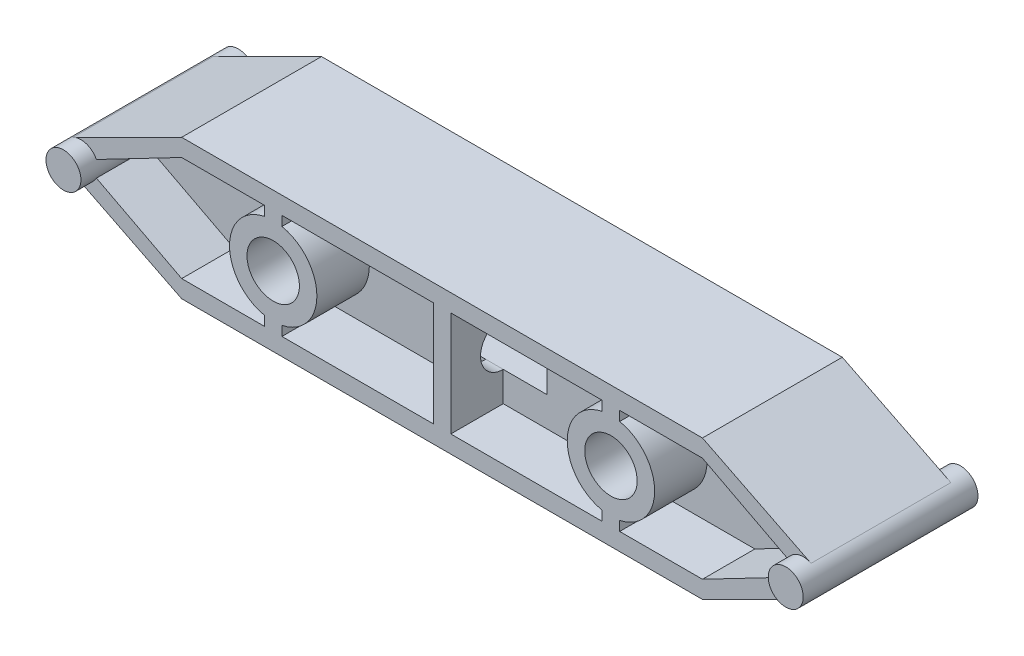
SolidWorks part; units mm, degrees
ref_plane "Front Plane" through (0, 0, 0) normal (0, 0, 1) x (1, 0, 0)
ref_plane "Top Plane" through (0, 0, 0) normal (0, 1, 0) x (1, 0, 0)
ref_plane "Right Plane" through (0, 0, 0) normal (1, 0, 0) x (0, 0, -1)
sketch "Sketch1" plane through (0, 0, 0) normal (0, 0, 1) x (1, 0, 0)
  line L0 (-74.6332, 0) -> (-16.4738, 0)
  line L1 (-64.4732, -5.08) -> (-64.4732, 5.08)
  line L2 (-74.6332, 0) -> (-64.4732, 5.08)
  line L3 (-74.6332, 0) -> (-64.4732, -5.08)
  line L4 (-26.6338, -5.08) -> (-26.6338, 5.08)
  line L5 (-26.6338, 5.08) -> (-16.4738, 0)
  line L6 (-26.6338, -5.08) -> (-16.4738, 0)
  line L7 (-64.4732, 5.08) -> (-26.6338, 5.08)
  line L8 (-64.4732, -5.08) -> (-26.6338, -5.08)
  point P6 (-64.4732, 0)
  point P9 (-26.6338, 0)
  dimension "D1" = 58.1594
  dimension "D2" = 90
  dimension "D3" = 10.16
  dimension "D4" = 10.16
  dimension "D5" = 90
  dimension "D6" = 10.16
  dimension "D7" = 10.16
extrude "Boss-Extrude3" add sketch "Sketch1" along normal blind 10.16 contours L2 L0 L1 | L0 L3 L1 | L7 L1 L0 L4 | L1 L8 L4 L0 | L4 L6 L0 | L5 L4 L0
sketch "Sketch4" plane through (0, 0, 10.16) normal (0, 0, 1) x (1, 0, 0)
  line L0 (-74.6332, 0) -> (-64.4732, -5.08) construction
  line L1 (-74.6332, 0) -> (-64.4732, 5.08) construction
  line L2 (-26.6338, -5.08) -> (-16.4738, 0) construction
  line L3 (-26.6338, 5.08) -> (-16.4738, 0) construction
  line L4 (-26.6338, 5.08) -> (-26.6338, 3.81)
  line L5 (-26.6338, -5.08) -> (-26.6338, -3.81)
  line L6 (-26.6338, 3.81) -> (-20.4402, 0.5863)
  line L7 (-26.6338, -3.81) -> (-20.4402, -0.5863)
  line L8 (-64.4732, 5.08) -> (-64.4732, 3.81)
  line L9 (-64.4732, -5.08) -> (-64.4732, -3.81)
  line L10 (-64.4732, 3.81) -> (-70.6668, 0.5863)
  line L11 (-64.4732, -3.81) -> (-70.6668, -0.5863)
  line L12 (-64.4732, -3.81) -> (-26.6338, -3.81)
  line L13 (-26.6338, 3.81) -> (-64.4732, 3.81)
  circle A0 centre (-71.7934, 0) radius 1.27
  circle A1 centre (-19.3136, 0) radius 1.27
  dimension "D1" = 2.54
  dimension "D2" = 2.54
  dimension "D3" = 1.27
  dimension "D4" = 1.27
  dimension "D5" = 1.27
  dimension "D6" = 1.27
extrude "Cut-Extrude1" cut sketch "Sketch4" against normal blind 3.81 contours A1 L6 L13 L10 A0 L11 L12 L7
sketch "Sketch6" plane through (0, 0, 10.16) normal (0, 0, 1) x (1, 0, 0)
  line L0 (-26.6338, -5.08) -> (-16.4738, 0) construction
  line L1 (-26.6338, 5.08) -> (-16.4738, 0) construction
  line L2 (-74.6332, 0) -> (-64.4732, -5.08) construction
  line L3 (-74.6332, 0) -> (-64.4732, 5.08) construction
  circle A0 centre (-71.7934, 0) radius 1.27
  circle A1 centre (-19.3136, 0) radius 1.27
  dimension "D1" = 2.54
  dimension "D2" = 2.54
extrude "Boss-Extrude4" add sketch "Sketch6" along normal blind 1.27
sketch "Sketch7" plane through (0, 0, 10.16) normal (0, 0, 1) x (1, 0, 0)
  line L0 (-16.4738, 0) -> (-18.7457, 1.1359) construction
  line L1 (-18.7457, -1.1359) -> (-16.4738, 0) construction
  line L2 (-72.3613, 1.1359) -> (-74.6332, 0) construction
  line L3 (-74.6332, 0) -> (-72.3613, -1.1359) construction
  line L4 (-16.4738, 0) -> (-18.7457, 1.1359)
  line L5 (-18.7457, -1.1359) -> (-16.4738, 0)
  line L6 (-72.3613, 1.1359) -> (-74.6332, 0)
  line L7 (-74.6332, 0) -> (-72.3613, -1.1359)
  arc A0 (-18.7457, -1.1359) -> (-18.7457, 1.1359) centre (-19.3136, 0) ccw construction
  arc A1 (-72.3613, 1.1359) -> (-72.3613, -1.1359) centre (-71.7934, 0) ccw construction
  arc A2 (-18.7457, -1.1359) -> (-18.7457, 1.1359) centre (-19.3136, 0) ccw
  arc A3 (-72.3613, 1.1359) -> (-72.3613, -1.1359) centre (-71.7934, 0) ccw
extrude "Cut-Extrude2" cut sketch "Sketch7" against normal through all
sketch "Sketch9" plane through (0, 0, 0) normal (0, 0, -1) x (-1, 0, 0)
  circle A0 centre (19.3136, 0) radius 1.27
  circle A1 centre (71.7934, 0) radius 1.27
  arc A2 (72.3613, -1.1359) -> (72.3613, 1.1359) centre (71.7934, 0) ccw construction
  arc A3 (18.7457, 1.1359) -> (18.7457, -1.1359) centre (19.3136, 0) ccw construction
  dimension "D1" = 2.54
  dimension "D2" = 2.54
extrude "Boss-Extrude5" add sketch "Sketch9" along normal blind 1.27
sketch "Sketch10" plane through (0, 0, 0) normal (0, 0, -1) x (-1, 0, 0)
  line L0 (26.6338, 5.08) -> (26.6338, 3.81)
  line L1 (26.6338, -5.08) -> (26.6338, -3.81)
  line L2 (26.6338, 3.81) -> (18.0436, 0)
  line L3 (26.6338, -3.81) -> (18.0436, 0)
  line L4 (64.4732, 5.08) -> (64.4732, 3.81)
  line L5 (64.4732, -5.08) -> (64.4732, -3.81)
  line L6 (64.4732, -3.81) -> (70.6668, -0.5863)
  line L7 (64.4732, 3.81) -> (70.6668, 0.5863)
  line L8 (64.4732, -3.81) -> (26.6338, -3.81)
  line L9 (26.6338, 3.81) -> (64.4732, 3.81)
  arc A0 (18.7457, -1.1359) -> (18.7457, 1.1359) centre (19.3136, 0) ccw construction
  arc A1 (72.3613, 1.1359) -> (72.3613, -1.1359) centre (71.7934, 0) ccw construction
  circle A2 centre (71.7934, 0) radius 1.27 construction
  dimension "D1" = 1.27
  dimension "D2" = 1.27
  dimension "D3" = 1.27
  dimension "D4" = 1.27
extrude "Cut-Extrude3" cut sketch "Sketch10" against normal blind 3.81 contours L9 L2 L3 L8 L6 L7 M9 M5
sketch "Sketch11" plane through (0, 0, 6.35) normal (0, 0, 1) x (1, 0, 0)
  line L0 (-73.0634, 0) -> (-57.8234, 0)
  line L1 (-57.8234, 0) -> (-40.0434, 0)
  line L2 (-18.0436, 0) -> (-33.2836, 0)
  line L3 (-33.2836, 0) -> (-51.0636, 0)
  line L4 (-38.0114, 0) -> (-53.0956, 0)
  line L5 (-49.3635, 1.651) -> (-49.3635, -1.651)
  line L6 (-49.3635, 1.651) -> (-41.7435, 1.651)
  line L7 (-49.3635, -1.651) -> (-41.7435, -1.651)
  line L8 (-41.7435, 1.651) -> (-41.7435, -1.651)
  line L9 (-49.3635, 1.651) -> (-41.7435, -1.651) construction
  line L10 (-49.3635, -1.651) -> (-41.7435, 1.651) construction
  circle A0 centre (-71.7934, 0) radius 1.27 construction
  circle A1 centre (-57.8234, 0) radius 1.905
  circle A2 centre (-40.0434, 0) radius 2.032
  circle A3 centre (-19.3136, 0) radius 1.27 construction
  circle A4 centre (-33.2836, 0) radius 1.905
  circle A5 centre (-51.0636, 0) radius 2.032
  point P19 (-45.5535, 0)
  point P21 (-45.5535, 0)
  dimension "D2" = 3.81
  dimension "D4" = 4.064
  dimension "D7" = 3.81
  dimension "D8" = 4.064
  dimension "D1" = 15.24
  dimension "D3" = 17.78
  dimension "D5" = 15.24
  dimension "D6" = 17.78
  dimension "D9" = 7.62
  dimension "D10" = 3.302
extrude "Cut-Extrude5" cut sketch "Sketch11" against normal through all contours L0 A1 L1 | L1 A1 L0 | L8 L6 L5 L4 | L8 L4 L5 L7 | L2 A4 L3
sketch "Sketch12" plane through (0, 0, 6.35) normal (0, 0, 1) x (1, 0, 0)
  line L0 (-58.4584, 3.81) -> (-58.4584, -3.81)
  line L1 (-58.4584, 3.81) -> (-57.1884, 3.81)
  line L2 (-58.4584, -3.81) -> (-57.1884, -3.81)
  line L3 (-57.1884, 3.81) -> (-57.1884, -3.81)
  line L4 (-58.4584, 3.81) -> (-57.1884, -3.81) construction
  line L5 (-58.4584, -3.81) -> (-57.1884, 3.81) construction
  line L6 (-71.7934, 0) -> (-19.3136, 0) construction
  line L9 (-46.1885, 3.81) -> (-46.1885, -3.81)
  line L10 (-46.1885, 3.81) -> (-44.9185, 3.81)
  line L11 (-46.1885, -3.81) -> (-44.9185, -3.81)
  line L12 (-44.9185, 3.81) -> (-44.9185, -3.81)
  line L13 (-46.1885, 3.81) -> (-44.9185, -3.81) construction
  line L14 (-46.1885, -3.81) -> (-44.9185, 3.81) construction
  line L15 (-33.9186, 3.81) -> (-33.9186, -3.81)
  line L16 (-33.9186, 3.81) -> (-32.6486, 3.81)
  line L17 (-33.9186, -3.81) -> (-32.6486, -3.81)
  line L18 (-32.6486, 3.81) -> (-32.6486, -3.81)
  line L19 (-33.9186, 3.81) -> (-32.6486, -3.81) construction
  line L20 (-33.9186, -3.81) -> (-32.6486, 3.81) construction
  circle A0 centre (-57.8234, 0) radius 3.175
  circle A1 centre (-57.8234, 0) radius 1.905 construction
  circle A2 centre (-33.2836, 0) radius 3.175
  circle A3 centre (-33.2836, 0) radius 1.905 construction
  point P12 (-45.5535, 0)
  point P16 (-45.5535, 0)
  dimension "D1" = 1.27
  dimension "D4" = 1.27
  dimension "D2" = 1.27
  dimension "D3" = 1.27
  dimension "D5" = 1.27
extrude "Boss-Extrude6" add sketch "Sketch12" along normal blind 3.81
sketch "Sketch13" plane through (-46.1885, 0, 0) normal (-1, 0, 0) x (0, 0, 1)
  line L0 (6.35, 1.651) -> (6.35, -1.651) construction
  circle A0 centre (6.35, 0) radius 1.651
extrude "Cut-Extrude6" cut sketch "Sketch13" against normal blind 3.81
sketch "Sketch14" plane through (0, 0, 3.81) normal (0, 0, -1) x (-1, 0, 0)
  line L0 (32.6486, 3.81) -> (32.6486, -3.81)
  line L1 (32.6486, 3.81) -> (33.9186, 3.81)
  line L2 (32.6486, -3.81) -> (33.9186, -3.81)
  line L3 (33.9186, 3.81) -> (33.9186, -3.81)
  line L4 (32.6486, 3.81) -> (33.9186, -3.81) construction
  line L5 (32.6486, -3.81) -> (33.9186, 3.81) construction
  line L6 (57.1884, 3.81) -> (57.1884, -3.81)
  line L7 (57.1884, 3.81) -> (58.4584, 3.81)
  line L8 (57.1884, -3.81) -> (58.4584, -3.81)
  line L9 (58.4584, 3.81) -> (58.4584, -3.81)
  line L10 (57.1884, 3.81) -> (58.4584, -3.81) construction
  line L11 (57.1884, -3.81) -> (58.4584, 3.81) construction
  circle A0 centre (33.2836, 0) radius 3.175
  circle A1 centre (33.2836, 0) radius 1.905 construction
  circle A2 centre (57.8234, 0) radius 3.175
  circle A3 centre (57.8234, 0) radius 1.905 construction
  dimension "D1" = 1.27
  dimension "D3" = 1.27
  dimension "D2" = 1.27
  dimension "D4" = 1.27
extrude "Boss-Extrude7" add sketch "Sketch14" along normal blind 3.81 contours A2 L9 L6 M7 | L9 A2 L6 M6 | L6 A2 M6 | L9 A2 M6 | L6 A2 L9 M6 | A2 L6 L9 M11 | A0 L3 L0 M7 | L3 A0 L0 M3 | L0 A0 M3 | L0 A0 L3 M3 | A0 L0 L3 M11 | L3 A0 M3
sketch "Sketch15" plane through (0, 0, 6.35) normal (0, 0, 1) x (1, 0, 0)
  line L1 (-49.3635, 1.651) -> (-41.7435, 1.651)
  line L2 (-49.3635, 1.651) -> (-49.3635, -1.651)
  line L3 (-49.3635, -1.651) -> (-41.7435, -1.651)
  line L4 (-41.7435, 1.651) -> (-41.7435, -1.651)
extrude "Cut-Extrude7" cut sketch "Sketch15" against normal blind 10
